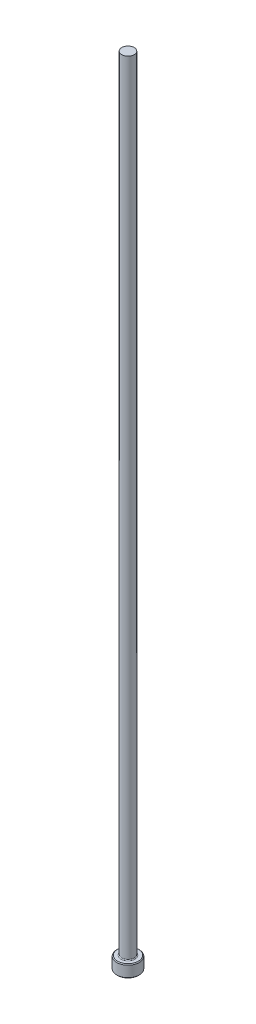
SolidWorks part; units mm, degrees
ref_plane "Front Plane" through (0, 0, 0) normal (0, 0, 1) x (1, 0, 0)
ref_plane "Top Plane" through (0, 0, 0) normal (0, 1, 0) x (1, 0, 0)
ref_plane "Right Plane" through (0, 0, 0) normal (1, 0, 0) x (0, 0, -1)
sketch "Sketch1" plane through (0, 0, 0) normal (0, 0, 1) x (1, 0, 0)
  line L0 (0, 259.9588) -> (0, -15.1925) construction
  line L1 (0, 0) -> (-3.5687, 0)
  line L2 (-3.5687, 0) -> (-3.5687, 3.9624)
  line L3 (-3.5687, 3.9624) -> (-1.9837, 3.9624)
  line L4 (-1.9837, 3.9624) -> (-1.9837, 254)
  line L5 (-1.9837, 254) -> (0, 254)
  line L6 (0, 254) -> (0, 0)
  dimension "L" = 254
  dimension "H" = 7.1374
  dimension "T" = 3.9624
  dimension "D" = 3.9675
revolve "Revolve1" add sketch "Sketch1" angle 360 about L0
chamfer "Chamfer1" distance 0.254 angle 45 2 edges at (0, 3.9624, 3.5687) (0, 0, 3.5687)
fillet "Fillet1" radius 0.254 1 edges at (0, 3.9624, 1.9837)
sketch "Pocket Sketch" plane through (0, 0, 0) normal (0, 0, 1) x (1, 0, 0)
  line L0 (-3.9656, 0) -> (-3.9656, 3.9878)
  line L1 (-3.9656, 3.9878) -> (-2.9442, 3.9878)
  line L2 (-2.1822, 4.7498) -> (-2.1822, 22.225)
  line L3 (-2.1822, 22.225) -> (0, 22.225)
  line L4 (0, 22.225) -> (0, 0)
  line L5 (0, 0) -> (-3.9656, 0)
  line L6 (0, 12.6104) -> (0, -2.4989) construction
  line L7 (-3.5687, 3.7084) -> (-3.5687, 0.254) construction
  line L8 (3.3147, 3.9624) -> (-3.3147, 3.9624) construction
  line L9 (-1.9837, 254) -> (-1.9837, 4.2164) construction
  line L10 (-2.9442, 3.9878) -> (-2.1822, 4.7498)
  point P3 (-2.1822, 3.9878)
  dimension "D1" = 7.9311
  dimension "D2" = 0.3969
  dimension "D3" = 0.0254
  dimension "D4" = 0.1984
  dimension "D5" = 4.3644
  dimension "D6" = 22.225
